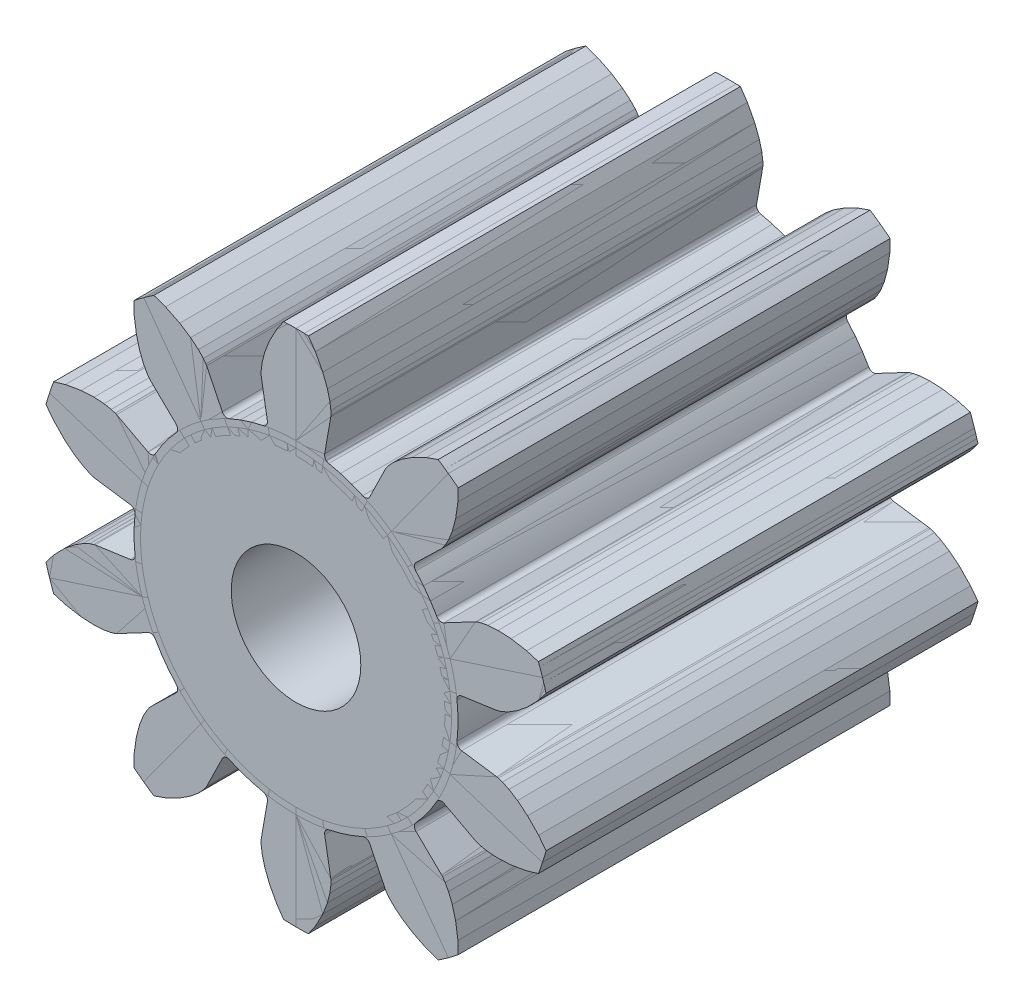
SolidWorks part; units mm, degrees
ref_plane "Face" through (0, 0, 0) normal (0, 0, 1) x (1, 0, 0)
ref_plane "Dessus" through (0, 0, 0) normal (0, 1, 0) x (1, 0, 0)
ref_plane "Droite" through (0, 0, 0) normal (1, 0, 0) x (0, 0, -1)
imported_body "Importée1"
sketch "Esquisse1" plane through (0, 0, 0) normal (0, 0, 1) x (1, 0, 0)
  circle A0 centre (0, 0) radius 0.75
  circle A1 centre (0, 0) radius 1.725
  circle A2 centre (0, 0) radius 1.725 construction
  dimension "D1" = 1.5
extrude "Boss.-Extru.1" add sketch "Esquisse1" against normal blind 5
